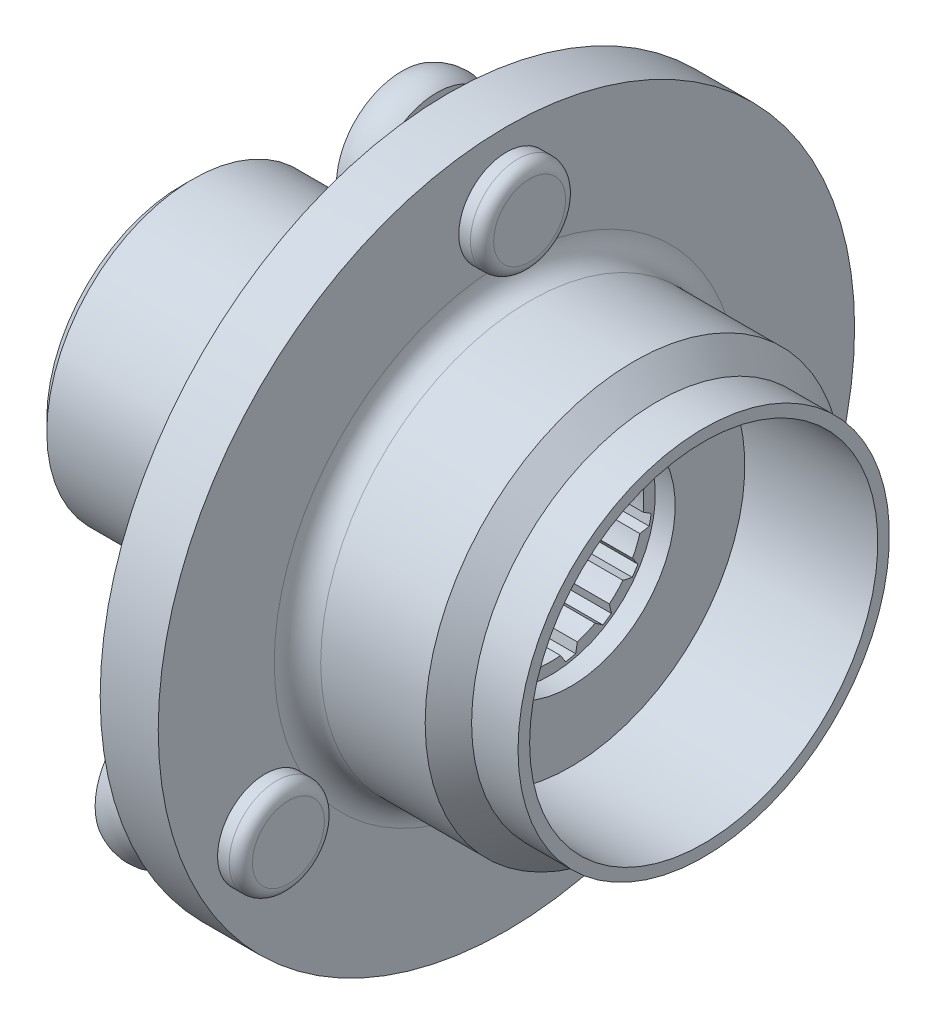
SolidWorks part; units mm, degrees
ref_plane "Plane1" through (0, 0, 0) normal (0, 0, 1) x (1, 0, 0)
ref_plane "Plane2" through (0, 0, 0) normal (0, 1, 0) x (1, 0, 0)
ref_plane "Plane3" through (0, 0, 0) normal (1, 0, 0) x (0, 0, -1)
sketch "Esquisse1" plane through (0, 0, 0) normal (0, 0, 1) x (1, 0, 0)
  line L0 (0, 6.5) -> (0, 15)
  line L1 (0, 15) -> (2.5, 15)
  line L2 (2.5, 15) -> (2.5, 10)
  line L3 (3.5, 9) -> (8, 9)
  line L4 (0, 0) -> (14, 0) construction
  line L5 (9, 8) -> (11, 8)
  line L6 (11, 8) -> (11, 7.5)
  line L7 (-4, 6.3) -> (-11, 6.3)
  line L8 (-11.5, 5.8) -> (-11.5, 4.9844)
  line L9 (11, 7.5) -> (5.2709, 7.5)
  line L10 (5.2709, 7.5) -> (5.2709, 4.5)
  line L11 (5.2709, 4.5) -> (4.4147, 4.5)
  line L12 (4.4147, 4.5) -> (4.4147, 4)
  line L13 (4.4147, 4) -> (-7.0485, 4)
  line L14 (-7.0485, 4) -> (-7.0485, 4.5)
  line L15 (-11.5, 4.9844) -> (-11.0156, 4.5)
  line L16 (-7.0485, 4.5) -> (-11.0156, 4.5)
  line L17 (-11.5, 5.8) -> (-11, 6.3)
  line L18 (8, 9) -> (9, 8)
  line L19 (0, 6.5) -> (-4, 6.5)
  line L20 (-4, 6.5) -> (-4, 6.3)
  arc A0 (2.5, 10) -> (3.5, 9) centre (3.5, 10) ccw
  dimension "D1" = 2.5
  dimension "D2" = 7.5
  dimension "D3" = 8
  dimension "D5" = 15
  dimension "D8" = 6.3
  dimension "D9" = 1
  dimension "D10" = 11
  dimension "D11" = 8
  dimension "D12" = 11.5
  dimension "D4" = 9
  dimension "D6" = 4
  dimension "D7" = 4.5
  dimension "D13" = 6.5
revolve "Base-Révolution" add sketch "Esquisse1" angle 360 about L4
sketch "Esquisse2" plane through (0, 0, 0) normal (0, 0, 1) x (1, 0, 0)
  line L1 (-2, 14.8259) -> (-2, 12)
  line L2 (-4, 12) -> (7, 12) construction
  line L3 (-2, 12) -> (3.5, 12)
  line L4 (-0.5, 13.5) -> (2.5, 13.5)
  line L5 (2.5, -15) -> (2.5, 15) construction
  line L7 (2.5, 14.0498) -> (3, 14.0498)
  line L8 (3.5, 13.5498) -> (3.5, 12)
  line L11 (2.5, 13.5) -> (2.5, 14.0498)
  line L12 (-0.5, 13.5) -> (-0.5, 14.7716)
  arc A0 (3.5, 13.5498) -> (3, 14.0498) centre (3, 13.5498) ccw
  arc A1 (-0.5, 14.7716) -> (-2, 14.8259) centre (-1.2971, 13.5) ccw
  dimension "D2" = 0.5
  dimension "D1" = 1
  dimension "D3" = 3
  dimension "D4" = 1.5
  dimension "D5" = 1.5
revolve "Boss.-Révol.1" add sketch "Esquisse2" angle 360 about L2
pattern_circular "Répétition circulaire1" count 3 every 120 about axis through (0, 0, 0) along (1, 0, 0)
sketch "Esquisse3" plane through (-7.0485, 0, 0) normal (-1, 0, 0) x (0, 0, 1)
  line L0 (0, 0) -> (0, 6) construction
  line L1 (0, 0) -> (-1.1867, 5.9659) construction
  line L2 (0, 0) -> (-2.2196, 5.3585) construction
  line L3 (-0.2862, 3.7766) -> (-0.6348, 4.3248)
  line L4 (-1.0686, 4.2385) -> (-0.6348, 4.3248)
  line L5 (-1.1808, 3.5986) -> (-0.2862, 3.7766)
  line L6 (-1.1808, 3.5986) -> (-1.0686, 4.2385)
  circle A0 centre (0, 0) radius 5.8 construction
  point P11 (-0.7335, 3.6876)
  point P13 (-0.8517, 4.2816)
  dimension "D1" = 11.25
  dimension "D2" = 11.25
extrude "Enlèv. mat.-Extru.1" cut sketch "Esquisse3" against normal through all
pattern_circular "Répétition circulaire2" count 16 every 22.5 about axis through (0, 0, 0) along (1, 0, 0)
